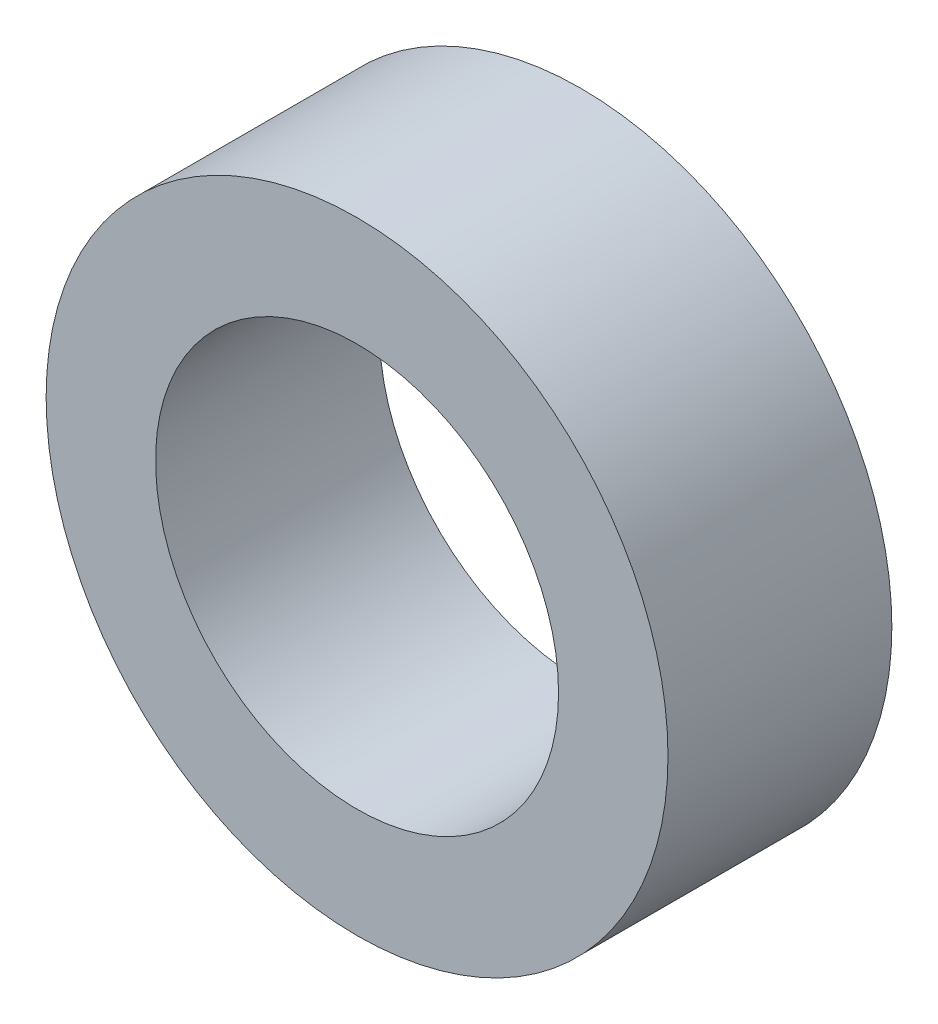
SolidWorks part; units mm, degrees
ref_plane "Plan de face" through (0, 0, 0) normal (0, 0, 1) x (1, 0, 0)
ref_plane "Plan de dessus" through (0, 0, 0) normal (0, 1, 0) x (1, 0, 0)
ref_plane "Plan de droite" through (0, 0, 0) normal (1, 0, 0) x (0, 0, -1)
sketch "Esquisse1" plane through (0, 0, 0) normal (0, 0, 1) x (1, 0, 0)
  circle A0 centre (0, 0) radius 12.5
  circle A1 centre (0, 0) radius 8.1
  dimension "D1" = 25
  dimension "D2" = 16.2
extrude "Extrusion1" add sketch "Esquisse1" along normal blind 9
